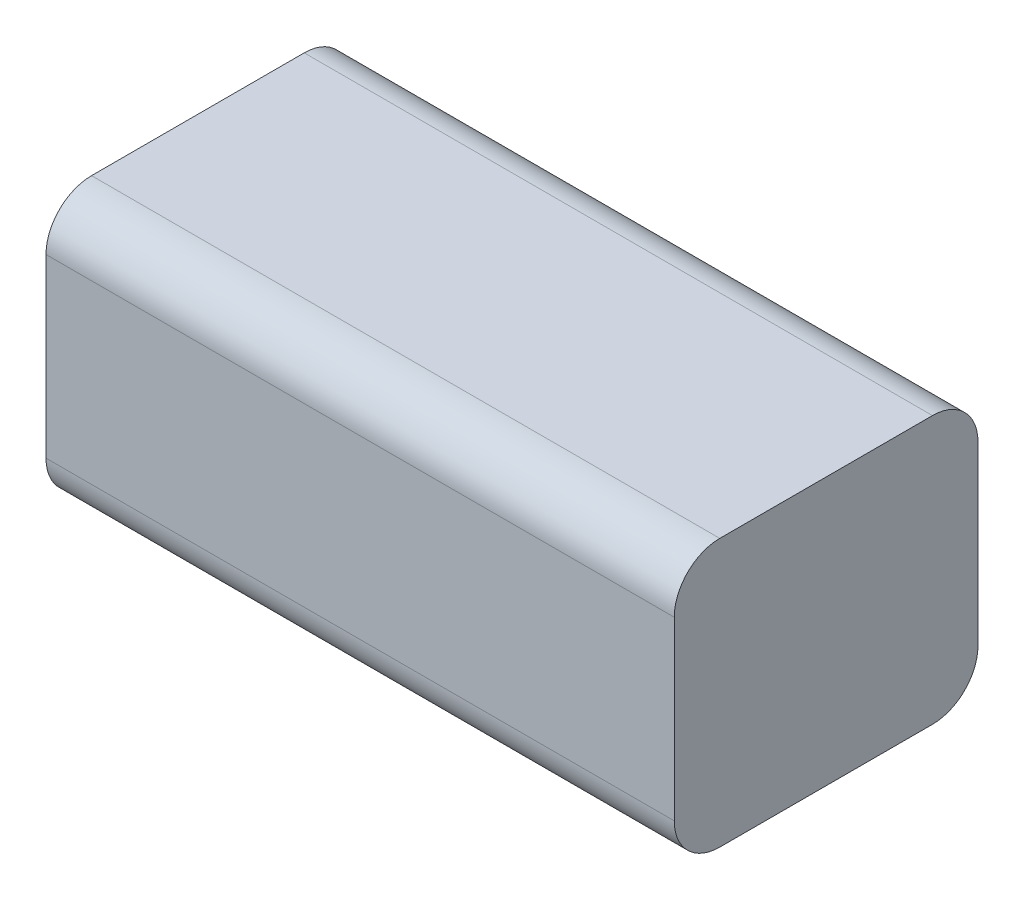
SolidWorks part; units mm, degrees
ref_plane "Front Plane" through (0, 0, 0) normal (0, 0, 1) x (1, 0, 0)
ref_plane "Top Plane" through (0, 0, 0) normal (0, 1, 0) x (1, 0, 0)
ref_plane "Right Plane" through (0, 0, 0) normal (1, 0, 0) x (0, 0, -1)
sketch "Sketch1" plane through (0, 0, 0) normal (1, 0, 0) x (0, 0, -1)
  line L1 (-16.68, -14.685) -> (16.68, -14.685)
  line L2 (-16.68, -14.685) -> (-16.68, 14.685)
  line L3 (-16.68, 14.685) -> (16.68, 14.685)
  line L4 (16.68, -14.685) -> (16.68, 14.685)
  line L5 (-16.68, -14.685) -> (16.68, 14.685) construction
  line L6 (-16.68, 14.685) -> (16.68, -14.685) construction
  point P0 (0, 0)
  dimension "D1" = 29.37
  dimension "D2" = 33.36
extrude "Boss-Extrude1" add sketch "Sketch1" along normal blind 69
fillet "Fillet1" radius 5 4 edges at (34.5, -14.685, 16.68) (34.5, -14.685, -16.68) (34.5, 14.685, 16.68) (34.5, 14.685, -16.68)
scale "Scale1" scale about centroid uniform scaling yes scale factor 0.7
